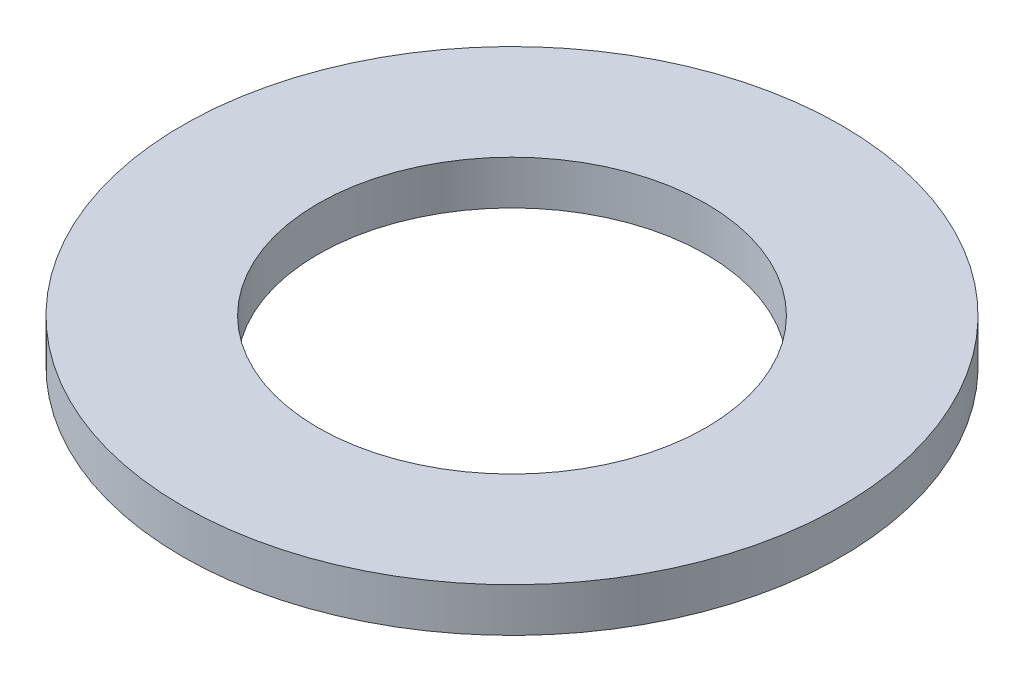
SolidWorks part; units mm, degrees
ref_plane "Face" through (0, 0, 0) normal (0, 0, 1) x (1, 0, 0)
ref_plane "Dessus" through (0, 0, 0) normal (0, 1, 0) x (1, 0, 0)
ref_plane "Droite" through (0, 0, 0) normal (1, 0, 0) x (0, 0, -1)
sketch "Esquisse1" plane through (0, 0, 0) normal (0, 0, 1) x (1, 0, 0)
  line L0 (0, 0) -> (0, 29.112) construction
  line L2 (2.65, 0) -> (4.5, 0)
  line L3 (2.65, 0) -> (2.65, 0.6)
  line L4 (2.65, 0.6) -> (4.5, 0.6)
  line L5 (4.5, 0) -> (4.5, 0.6)
  dimension "D1" = 5.3
  dimension "D2" = 9
  dimension "D3" = 0.6
revolve "Révolution2" add sketch "Esquisse1" angle 360 about L0
